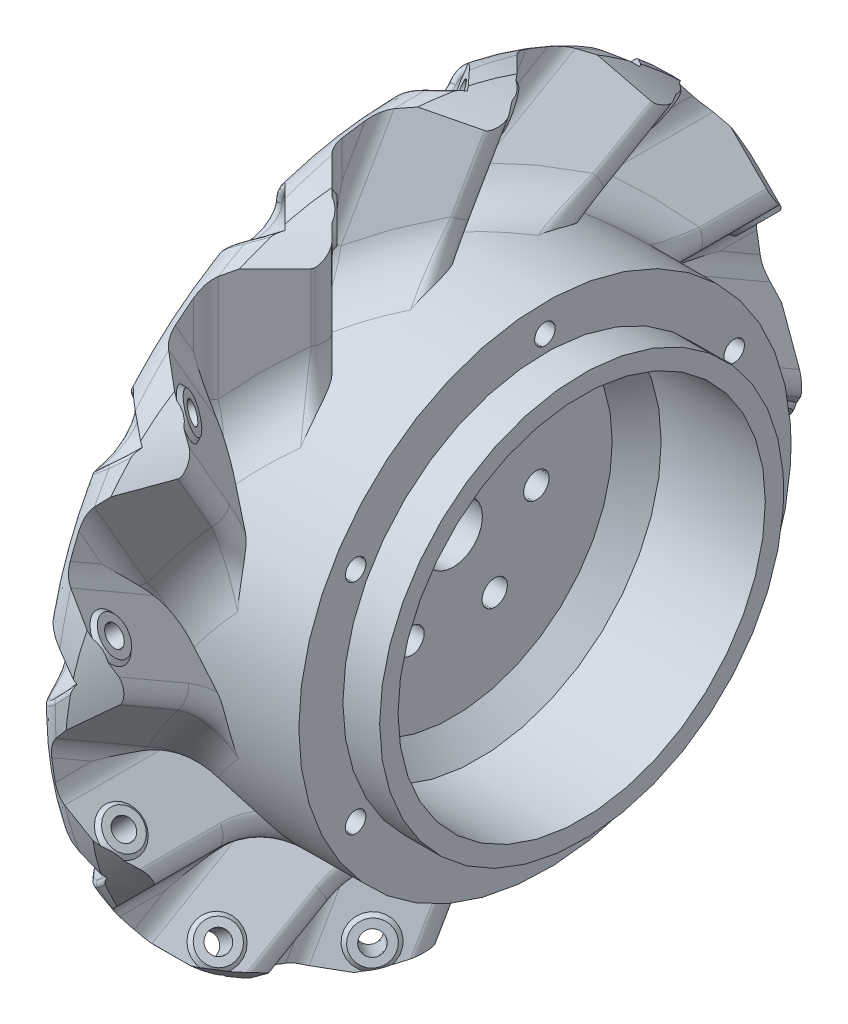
SolidWorks part; units mm, degrees
other "Volumenkörper1[1]"
other "<MecanumA_pieza>-<Volumenkörper2[1]>"
other "<MecanumA_pieza>-<Redondeo7>"
ref_plane "Alzado" through (0, 0, 0) normal (0, 0, 1) x (1, 0, 0)
ref_plane "Planta" through (0, 0, 0) normal (0, 1, 0) x (1, 0, 0)
ref_plane "Vista lateral" through (0, 0, 0) normal (1, 0, 0) x (0, 0, -1)
imported_body "omniWheel2_B.stp<1>"
scale "Escala1" scale about centroid uniform scaling yes scale factor 0.75
sketch "Croquis2" plane through (-29.8742, 0, 29.8742) normal (-0.7071, 0, 0.7071) x (0.7071, 0, 0.7071)
  circle A0 centre (-4.7485, 64.7387) radius 2.15
  dimension "D1" = 4.3
extrude "BarrenoEjeRodillo" cut sketch "Croquis2" against normal blind 10
pattern_circular "MatrizEjeRodillo" count 12 over 360 about axis through (-30.5881, 0, 0) along (-1, 0, 0) of "BarrenoEjeRodillo"
sketch "Croquis6" plane through (-38.0881, 0, 0) normal (-1, 0, 0) x (0, 0, 1)
  circle A0 centre (0, 0) radius 32.8229
  circle A1 centre (0, 0) radius 17.297
extrude "Saliente-Extruir1" add sketch "Croquis6" against normal up to surface (12.6227 mm away)
sketch "Croquis3" plane through (-38.0881, 0, 0) normal (-1, 0, 0) x (0, 0, 1)
  circle A6 centre (0, 44.625) radius 2.1
  circle A7 centre (0, 44.625) radius 2.0625 construction
  circle A8 centre (38.6464, 22.3125) radius 2.1
  circle A9 centre (38.6464, -22.3125) radius 2.1
  circle A10 centre (0, -44.625) radius 2.1
  circle A11 centre (-38.6464, -22.3125) radius 2.1
  circle A12 centre (-38.6464, 22.3125) radius 2.1
  circle A13 centre (8.5, 14.7224) radius 2.1 construction
  circle A14 centre (17, 0) radius 2.1 construction
  circle A15 centre (0, 0) radius 17 construction
  circle A16 centre (8.5, 14.7224) radius 2.6
  circle A17 centre (17, 0) radius 2.6
  circle A18 centre (8.5, -14.7224) radius 2.6
  circle A19 centre (-8.5, -14.7224) radius 2.6
  circle A20 centre (-17, 0) radius 2.6
  circle A21 centre (-8.5, 14.7224) radius 2.6
  circle A22 centre (8.5, -14.7224) radius 2.1 construction
  circle A23 centre (-8.5, -14.7224) radius 2.1 construction
  circle A24 centre (-17, 0) radius 2.1 construction
  circle A25 centre (-8.5, 14.7224) radius 2.1 construction
  point P15 (0, 0)
  point P32 (0, 0)
  point P40 (0, 0)
  point P46 (0, 0)
  dimension "D1" = 34
  dimension "D3" = 4.2
  dimension "D4" = 6
  dimension "D5" = 6
  dimension "D2" = 5.2
  dimension "D6" = 4.2
  dimension "D7" = 6
extrude "BarrenoTornillosEnsamble" cut sketch "Croquis3" against normal through all
sketch "Croquis8" plane through (-38.0881, 0, 0) normal (-1, 0, 0) x (0, 0, 1)
  line L0 (38.6464, 18.1556) -> (42.2464, 20.234)
  line L1 (0, 48.7819) -> (-3.6, 46.7035)
  line L2 (-3.6, 46.7035) -> (-3.6, 42.5465)
  line L3 (-3.6, 42.5465) -> (0, 40.4681)
  line L4 (0, 40.4681) -> (3.6, 42.5465)
  line L5 (3.6, 42.5465) -> (3.6, 46.7035)
  line L6 (3.6, 46.7035) -> (0, 48.7819)
  line L7 (42.2464, 20.234) -> (42.2464, 24.391)
  line L8 (42.2464, 24.391) -> (38.6464, 26.4694)
  line L9 (38.6464, 26.4694) -> (35.0464, 24.391)
  line L10 (35.0464, 24.391) -> (35.0464, 20.234)
  line L11 (35.0464, 20.234) -> (38.6464, 18.1556)
  line L12 (35.0464, -24.391) -> (38.6464, -26.4694)
  line L13 (38.6464, -26.4694) -> (42.2464, -24.391)
  line L14 (42.2464, -24.391) -> (42.2464, -20.234)
  line L15 (42.2464, -20.234) -> (38.6464, -18.1556)
  line L16 (38.6464, -18.1556) -> (35.0464, -20.234)
  line L17 (35.0464, -20.234) -> (35.0464, -24.391)
  line L18 (-3.6, -42.5465) -> (-3.6, -46.7035)
  line L19 (-3.6, -46.7035) -> (0, -48.7819)
  line L20 (0, -48.7819) -> (3.6, -46.7035)
  line L21 (3.6, -46.7035) -> (3.6, -42.5465)
  line L22 (3.6, -42.5465) -> (0, -40.4681)
  line L23 (0, -40.4681) -> (-3.6, -42.5465)
  line L24 (-38.6464, -18.1556) -> (-42.2464, -20.234)
  line L25 (-42.2464, -20.234) -> (-42.2464, -24.391)
  line L26 (-42.2464, -24.391) -> (-38.6464, -26.4694)
  line L27 (-38.6464, -26.4694) -> (-35.0464, -24.391)
  line L28 (-35.0464, -24.391) -> (-35.0464, -20.234)
  line L29 (-35.0464, -20.234) -> (-38.6464, -18.1556)
  line L30 (-35.0464, 24.391) -> (-38.6464, 26.4694)
  line L31 (-38.6464, 26.4694) -> (-42.2464, 24.391)
  line L32 (-42.2464, 24.391) -> (-42.2464, 20.234)
  line L33 (-42.2464, 20.234) -> (-38.6464, 18.1556)
  line L34 (-38.6464, 18.1556) -> (-35.0464, 20.234)
  line L35 (-35.0464, 20.234) -> (-35.0464, 24.391)
  circle A0 centre (0, 44.625) radius 3.6 construction
  point P10 (3.6, 44.625)
  point P43 (0, 0)
  dimension "D1" = 7.2
  dimension "D2" = 6
extrude "Cortar-Extruir1" cut sketch "Croquis8" against normal blind 5
sketch "Croquis4" plane through (-25.4655, 0, 0) normal (1, 0, 0) x (0, 0, -1)
  circle A0 centre (0, 0) radius 6
  circle A2 centre (0, 0) radius 14
  dimension "D1" = 12
  dimension "D3" = 28
extrude "RellenoCentral" add sketch "Croquis4" against normal up to surface (12.6227 mm away)
sketch "Croquis5" plane through (-38.0881, 0, 0) normal (-1, 0, 0) x (0, 0, 1)
  circle A0 centre (0, 0) radius 11.1
  dimension "D1" = 22.2
extrude "CorteBalero" cut sketch "Croquis5" against normal blind 6.4
chamfer "Chaflán1" distance 5 angle 45 1 edges at (-25.4655, 0, 37.5)
fillet "Redondeo8" radius 3 13 edges
fillet "Redondeo4" radius 5 24 edges
fillet "Redondeo5" radius 0.8 50 edges
chamfer "Chaflán2" distance 0.5 angle 45 1 edges at (-38.0881, 0, 11.1)
inserted part "AMR-1211_CuerpoMecanum_A_RH1"
move or copy body "Sólido-Mover/Copiar2" placed by mates yes parameters "D1"=0, "D2"=0, "D3"=0
delete or keep bodies "Sólido-Eliminar/Conservar 1" type delete bodies bodies 117
